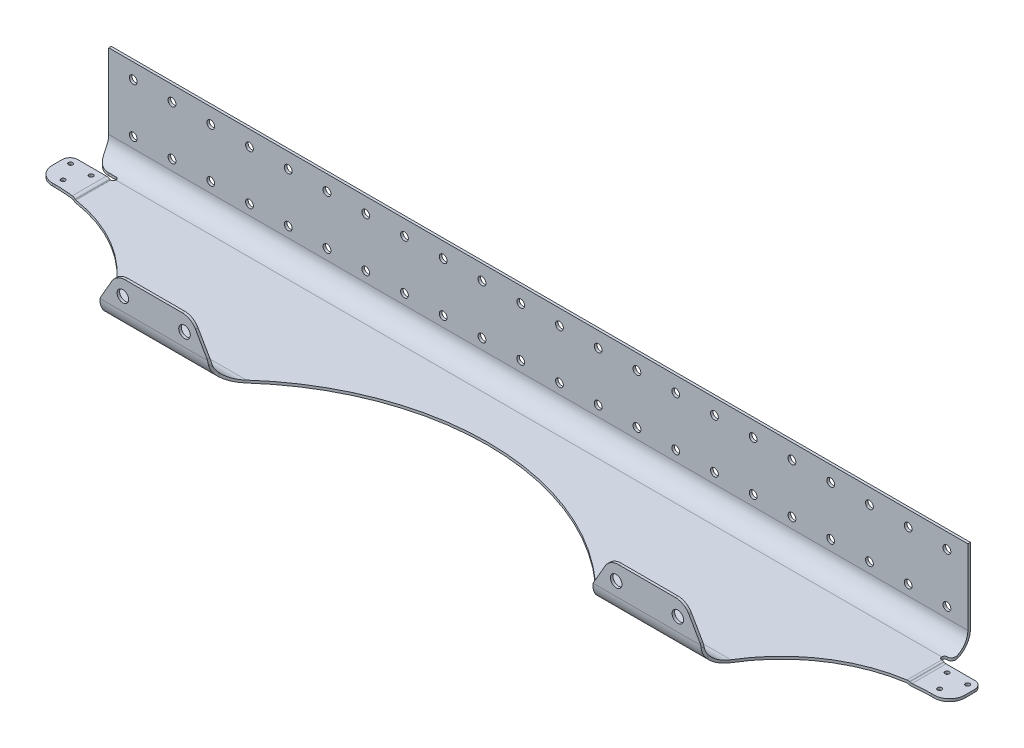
SolidWorks part; units mm, degrees
ref_plane "Front Plane" through (0, 0, 0) normal (1, 0, 0) x (0, 1, 0)
ref_plane "Top Plane" through (0, 0, 0) normal (0, 0, 1) x (0, 1, 0)
ref_plane "Right Plane" through (0, 0, 0) normal (0, 1, 0) x (-1, 0, 0)
sketch "sk 5dia hole pat" plane through (0, 0, 0) normal (0, 0, 1) x (0, 1, 0)
  line L4 (-30.48, -48.26) -> (30.48, -48.26) construction
  point P3 (0, -48.26)
  circle B0 centre (30.48, -579.12) radius 4.826
  circle B1 centre (1188.72, 579.12) radius 4.826
  circle B2 centre (78.74, -579.12) radius 4.826
  circle B3 centre (127, -579.12) radius 4.826
  circle B4 centre (175.26, -579.12) radius 4.826
  circle B5 centre (223.52, -579.12) radius 4.826
  circle B6 centre (271.78, -579.12) radius 4.826
  circle B7 centre (320.04, -579.12) radius 4.826
  circle B8 centre (368.3, -579.12) radius 4.826
  circle B9 centre (416.56, -579.12) radius 4.826
  circle B10 centre (464.82, -579.12) radius 4.826
  circle B11 centre (513.08, -579.12) radius 4.826
  circle B12 centre (561.34, -579.12) radius 4.826
  circle B13 centre (609.6, -579.12) radius 4.826
  circle B14 centre (657.86, -579.12) radius 4.826
  circle B15 centre (706.12, -579.12) radius 4.826
  circle B16 centre (754.38, -579.12) radius 4.826
  circle B17 centre (802.64, -579.12) radius 4.826
  circle B18 centre (850.9, -579.12) radius 4.826
  circle B19 centre (899.16, -579.12) radius 4.826
  circle B20 centre (947.42, -579.12) radius 4.826
  circle B21 centre (995.68, -579.12) radius 4.826
  circle B22 centre (1043.94, -579.12) radius 4.826
  circle B23 centre (1092.2, -579.12) radius 4.826
  circle B24 centre (1140.46, -579.12) radius 4.826
  circle B25 centre (1188.72, -579.12) radius 4.826
  circle B26 centre (30.48, -530.86) radius 4.826
  circle B27 centre (30.48, -482.6) radius 4.826
  circle B28 centre (30.48, -434.34) radius 4.826
  circle B29 centre (30.48, -386.08) radius 4.826
  circle B30 centre (30.48, -337.82) radius 4.826
  circle B31 centre (30.48, -289.56) radius 4.826
  circle B32 centre (30.48, -241.3) radius 4.826
  circle B33 centre (30.48, -193.04) radius 4.826
  circle B34 centre (30.48, -144.78) radius 4.826
  circle B35 centre (30.48, -96.52) radius 4.826
  circle B36 centre (30.48, -48.26) radius 4.826
  circle B37 centre (30.48, 0) radius 4.826
  circle B38 centre (30.48, 48.26) radius 4.826
  circle B39 centre (30.48, 96.52) radius 4.826
  circle B40 centre (30.48, 144.78) radius 4.826
  circle B41 centre (30.48, 193.04) radius 4.826
  circle B42 centre (30.48, 241.3) radius 4.826
  circle B43 centre (30.48, 289.56) radius 4.826
  circle B44 centre (30.48, 337.82) radius 4.826
  circle B45 centre (30.48, 386.08) radius 4.826
  circle B46 centre (30.48, 434.34) radius 4.826
  circle B47 centre (30.48, 482.6) radius 4.826
  circle B48 centre (30.48, 530.86) radius 4.826
  circle B49 centre (30.48, 579.12) radius 4.826
  circle B50 centre (1140.46, 579.12) radius 4.826
  circle B51 centre (1092.2, 579.12) radius 4.826
  circle B52 centre (1043.94, 579.12) radius 4.826
  circle B53 centre (995.68, 579.12) radius 4.826
  circle B54 centre (947.42, 579.12) radius 4.826
  circle B55 centre (899.16, 579.12) radius 4.826
  circle B56 centre (850.9, 579.12) radius 4.826
  circle B57 centre (802.64, 579.12) radius 4.826
  circle B58 centre (754.38, 579.12) radius 4.826
  circle B59 centre (706.12, 579.12) radius 4.826
  circle B60 centre (657.86, 579.12) radius 4.826
  circle B61 centre (609.6, 579.12) radius 4.826
  circle B62 centre (561.34, 579.12) radius 4.826
  circle B63 centre (513.08, 579.12) radius 4.826
  circle B64 centre (464.82, 579.12) radius 4.826
  circle B65 centre (416.56, 579.12) radius 4.826
  circle B66 centre (368.3, 579.12) radius 4.826
  circle B67 centre (320.04, 579.12) radius 4.826
  circle B68 centre (271.78, 579.12) radius 4.826
  circle B69 centre (223.52, 579.12) radius 4.826
  circle B70 centre (175.26, 579.12) radius 4.826
  circle B71 centre (127, 579.12) radius 4.826
  circle B72 centre (78.74, 579.12) radius 4.826
  circle B73 centre (1188.72, 530.86) radius 4.826
  circle B74 centre (1188.72, 482.6) radius 4.826
  circle B75 centre (1188.72, 434.34) radius 4.826
  circle B76 centre (1188.72, 386.08) radius 4.826
  circle B77 centre (1188.72, 337.82) radius 4.826
  circle B78 centre (1188.72, 289.56) radius 4.826
  circle B79 centre (1188.72, 241.3) radius 4.826
  circle B80 centre (1188.72, 193.04) radius 4.826
  circle B81 centre (1188.72, 144.78) radius 4.826
  circle B82 centre (1188.72, 96.52) radius 4.826
  circle B83 centre (1188.72, 48.26) radius 4.826
  circle B84 centre (1188.72, 0) radius 4.826
  circle B85 centre (1188.72, -48.26) radius 4.826
  circle B86 centre (1188.72, -96.52) radius 4.826
  circle B87 centre (1188.72, -144.78) radius 4.826
  circle B88 centre (1188.72, -193.04) radius 4.826
  circle B89 centre (1188.72, -241.3) radius 4.826
  circle B90 centre (1188.72, -289.56) radius 4.826
  circle B91 centre (1188.72, -337.82) radius 4.826
  circle B92 centre (1188.72, -386.08) radius 4.826
  circle B93 centre (1188.72, -434.34) radius 4.826
  circle B94 centre (1188.72, -482.6) radius 4.826
  circle B95 centre (1188.72, -530.86) radius 4.826
  line B96 (609.6, -579.12) -> (609.6, -504.12) construction
  line B97 (30.48, 0) -> (105.48, 0) construction
  circle B98 centre (-30.48, 579.12) radius 4.826
  circle B99 centre (-175.26, -579.12) radius 4.826
  circle B100 centre (-127, -579.12) radius 4.826
  circle B101 centre (-30.48, -579.12) radius 4.826
  circle B102 centre (-1188.72, 96.52) radius 4.826
  circle B103 centre (-127, 579.12) radius 4.826
  circle B104 centre (-464.82, 579.12) radius 4.826
  circle B105 centre (-513.08, 579.12) radius 4.826
  circle B106 centre (-706.12, 579.12) radius 4.826
  circle B107 centre (-754.38, 579.12) radius 4.826
  circle B108 centre (-899.16, 579.12) radius 4.826
  circle B109 centre (-30.48, 530.86) radius 4.826
  circle B110 centre (-30.48, 482.6) radius 4.826
  circle B111 centre (-30.48, 434.34) radius 4.826
  circle B112 centre (-30.48, 386.08) radius 4.826
  circle B113 centre (-30.48, 337.82) radius 4.826
  circle B114 centre (-30.48, 289.56) radius 4.826
  circle B115 centre (-30.48, 241.3) radius 4.826
  circle B116 centre (-30.48, 193.04) radius 4.826
  circle B117 centre (-30.48, 144.78) radius 4.826
  circle B118 centre (-30.48, 96.52) radius 4.826
  circle B119 centre (-30.48, 48.26) radius 4.826
  circle B120 centre (-30.48, 0) radius 4.826
  circle B121 centre (-30.48, -48.26) radius 4.826
  circle B122 centre (-30.48, -96.52) radius 4.826
  circle B123 centre (-30.48, -144.78) radius 4.826
  circle B124 centre (-30.48, -241.3) radius 4.826
  circle B125 centre (-30.48, -289.56) radius 4.826
  circle B126 centre (-30.48, -337.82) radius 4.826
  circle B127 centre (-30.48, -386.08) radius 4.826
  circle B128 centre (-30.48, -434.34) radius 4.826
  circle B129 centre (-30.48, -482.6) radius 4.826
  circle B130 centre (-30.48, -530.86) radius 4.826
  line B131 (-1188.72, 0) -> (-1113.72, 0) construction
  dimension "D1" = 60.96
sketch_block_instance "5dia hole pat-1"
sketch_block "5dia hole pat" parameters "D1"=9.652, "D2"=9.652, "D3"=75
sketch_block_instance "5dia hole pat-2"
sketch "sk 47.986in pnl" plane through (0, 0, 0) normal (0, 0, 1) x (0, 1, 0)
  line B0 (0.1778, 0) -> (1219.0222, 0) construction
  line B1 (0.1778, 609.4222) -> (1219.0222, 609.4222)
  line B2 (0.1778, 609.4222) -> (0.1778, -609.4222)
  line B3 (0.1778, -609.4222) -> (1219.0222, -609.4222)
  line B4 (1219.0222, 609.4222) -> (1219.0222, -609.4222)
  line B5 (609.6, 609.4222) -> (609.6, -609.4222) construction
  dimension "D1" = 30.3022
sketch_block_instance "47.986in pnl-1"
sketch_block "47.986in pnl" parameters "D1"=1218.8444, "D2"=1218.8444
sketch "sk main body" plane through (0, 0, 0) normal (1, 0, 0) x (0, 1, 0)
  line L0 (49.53, 0) -> (-43.18, 0)
  line L1 (-68.58, 25.4) -> (-68.58, 158.75)
  line L2 (-43.18, 184.15) -> (-7.62, 184.15)
  line L3 (-26.67, 213.8401) -> (-26.67, 147.2198) construction
  line L4 (49.53, 3.175) -> (-43.18, 3.175)
  line L5 (-65.405, 25.4) -> (-65.405, 158.75)
  line L6 (-43.18, 180.975) -> (-7.62, 180.975)
  line L7 (-7.62, 184.15) -> (-7.62, 180.975)
  line L8 (49.53, 3.175) -> (49.53, 0)
  line L9 (670.3644, 0) -> (-670.3644, 0) construction
  arc A0 (-43.18, 0) -> (-68.58, 25.4) centre (-43.18, 25.4) cw
  arc A1 (-68.58, 158.75) -> (-43.18, 184.15) centre (-43.18, 158.75) cw
  arc A2 (-43.18, 3.175) -> (-65.405, 25.4) centre (-43.18, 25.4) cw
  arc A3 (-65.405, 158.75) -> (-43.18, 180.975) centre (-43.18, 158.75) cw
  dimension "D2" = 25.4
  dimension "D1" = 19.05
  dimension "D3" = 12.7
  dimension "D4" = 16.51
  dimension "D5" = 19.05
  dimension "D7" = 177.8
  dimension "D6" = 3.175
extrude "main body" add sketch "sk main body" along normal mid plane 1082.7022
sketch "sk upper holes" plane through (0, 0, 184.15) normal (0, 0, 1) x (1, 0, 0)
  line L0 (-609.4222, 0.1778) -> (-609.4222, 1219.0222) construction
  line L1 (609.4222, 0.1778) -> (609.4222, 1219.0222) construction
  line L2 (541.3511, -7.62) -> (-541.3511, -7.62) construction
  circle A2 centre (-342.9, -26.67) radius 16.51 construction
  circle A3 centre (-266.7, -26.67) radius 16.51 construction
  circle A4 centre (266.7, -26.67) radius 16.51 construction
  circle A5 centre (342.9, -26.67) radius 16.51 construction
  line B0 (-342.9, -26.67) -> (-266.7, -26.67) construction
  circle B1 centre (-342.9, -26.67) radius 7.1438
  circle B2 centre (-266.7, -26.67) radius 7.1438
  line B3 (266.7, -26.67) -> (342.9, -26.67) construction
  circle B4 centre (266.7, -26.67) radius 7.1438
  circle B5 centre (342.9, -26.67) radius 7.1438
  dimension "D1" = 304.8
  dimension "D2" = 304.8
  dimension "D6" = 33.02
  dimension "D7" = 33.02
  dimension "D8" = 33.02
  dimension "D9" = 33.02
  dimension "D3" = 304.6222
  dimension "D4" = 304.6222
  dimension "D5" = 19.05
sketch_block_instance "Upper bolt holes-1"
sketch_block "Upper bolt holes" parameters "D1"=14.2875, "D2"=14.2875, "D3"=76.2
sketch_block_instance "Upper bolt holes-2"
sketch "Sketch6" plane through (0, 0, 184.15) normal (0, 0, 1) x (1, 0, 0)
  line L0 (-371.4962, -43.18) -> (-304.8, 72.3411)
  line L1 (541.3511, -43.18) -> (-541.3511, -43.18) construction
  line L2 (-304.8, 72.3411) -> (-238.1038, -43.18)
  line L3 (-371.4962, -43.18) -> (-638.8127, -43.18)
  line L4 (-638.8127, -43.18) -> (-638.8127, 115.8831)
  line L6 (238.1038, -43.18) -> (304.8, 72.3411)
  line L7 (304.8, 72.3411) -> (371.4962, -43.18)
  line L8 (371.4962, -43.18) -> (645.1619, -43.18)
  line L9 (645.1619, -43.18) -> (645.1619, 115.8831)
  line L10 (-238.1038, -43.18) -> (238.1038, -43.18)
  line L11 (-638.8127, 115.8831) -> (645.1619, 115.8831)
  circle A0 centre (-342.9, -26.67) radius 16.51 construction
  circle A1 centre (-266.7, -26.67) radius 16.51 construction
  circle A2 centre (342.9, -26.67) radius 16.51 construction
  circle A3 centre (266.7, -26.67) radius 16.51 construction
  dimension "D1" = 60
  dimension "D2" = 60
  dimension "D3" = 60
  dimension "D4" = 60
extrude "Upper tabs" cut sketch "Sketch6" against normal blind 10
sketch "Sketch7" plane through (0, 0, 0) normal (0, 1, 0) x (-1, 0, 0)
  line L0 (-238.1038, 180.975) -> (-238.1038, 196.2087)
  line L4 (-238.1038, 196.2087) -> (238.1038, 196.2087)
  line L5 (238.1038, 196.2087) -> (238.1038, 180.975)
  line L6 (-541.3511, 25.4) -> (541.3511, 25.4) construction
  arc A2 (-238.1038, 180.975) -> (238.1038, 180.975) centre (0, 399.136) ccw
  point P2 (0, 76.2)
  dimension "D1" = 50.8
extrude "Side Mid curve" cut sketch "Sketch7" against normal through all
sketch "5dia hole for part" plane through (0, 0, 0) normal (0, 0, 1) x (0, 1, 0)
  line L1 (49.53, -541.3511) -> (49.53, 541.3511) construction
  line L2 (-43.18, -541.3511) -> (-43.18, 541.3511) construction
  line L3 (49.53, 541.3511) -> (-43.18, 541.3511) construction
  circle A52 centre (-30.48, 511.0489) radius 4.826
  circle A53 centre (30.48, 511.0489) radius 4.826
  circle A54 centre (30.48, 463.1699) radius 4.826
  circle A55 centre (-30.48, 463.1699) radius 4.826
  circle A56 centre (30.48, 415.2909) radius 4.826
  circle A57 centre (-30.48, 415.2909) radius 4.826
  circle A58 centre (30.48, 367.4119) radius 4.826
  circle A59 centre (-30.48, 367.4119) radius 4.826
  circle A60 centre (30.48, 319.5329) radius 4.826
  circle A61 centre (-30.48, 319.5329) radius 4.826
  circle A62 centre (30.48, 271.6539) radius 4.826
  circle A63 centre (-30.48, 271.6539) radius 4.826
  circle A64 centre (30.48, 223.7749) radius 4.826
  circle A65 centre (-30.48, 223.7749) radius 4.826
  circle A66 centre (30.48, 175.8959) radius 4.826
  circle A67 centre (-30.48, 175.8959) radius 4.826
  circle A68 centre (30.48, 128.0169) radius 4.826
  circle A69 centre (-30.48, 128.0169) radius 4.826
  circle A70 centre (30.48, 80.1379) radius 4.826
  circle A71 centre (-30.48, 80.1379) radius 4.826
  circle A72 centre (30.48, 32.2589) radius 4.826
  circle A73 centre (-30.48, 32.2589) radius 4.826
  circle A74 centre (30.48, -15.6201) radius 4.826
  circle A75 centre (-30.48, -15.6201) radius 4.826
  circle A76 centre (30.48, -63.4991) radius 4.826
  circle A77 centre (-30.48, -63.4991) radius 4.826
  circle A78 centre (30.48, -111.3781) radius 4.826
  circle A79 centre (-30.48, -111.3781) radius 4.826
  circle A80 centre (30.48, -159.2571) radius 4.826
  circle A81 centre (-30.48, -159.2571) radius 4.826
  circle A82 centre (30.48, -207.1361) radius 4.826
  circle A83 centre (-30.48, -207.1361) radius 4.826
  circle A84 centre (30.48, -255.0151) radius 4.826
  circle A85 centre (-30.48, -255.0151) radius 4.826
  circle A86 centre (30.48, -302.8941) radius 4.826
  circle A87 centre (-30.48, -302.8941) radius 4.826
  circle A88 centre (30.48, -350.7731) radius 4.826
  circle A89 centre (-30.48, -350.7731) radius 4.826
  circle A90 centre (30.48, -398.6521) radius 4.826
  circle A91 centre (-30.48, -398.6521) radius 4.826
  circle A92 centre (30.48, -446.5311) radius 4.826
  circle A93 centre (-30.48, -446.5311) radius 4.826
  circle A94 centre (30.48, -494.4101) radius 4.826
  circle A95 centre (-30.48, -494.4101) radius 4.826
  dimension "D4" = 9.652
  dimension "D5" = 9.652
  dimension "D1" = 30.3022
  dimension "D2" = 19.05
  dimension "D3" = 12.7
  dimension "D6" = 22
extrude "Holes Bot" cut sketch "5dia hole for part" along normal blind 10
extrude "Holes Top" cut sketch "sk upper holes" against normal blind 10
ref_plane "Tab Lower pln" through (0, 0, 25.4) normal (0, 0, 1) x (0, 1, 0)
sketch "sk Rivet holes" plane through (0, 0, 0) normal (0, 1, 0) x (-1, 0, 0)
  line L1 (541.3511, 0) -> (541.3511, 3.175) construction
  line L3 (64.9605, 25.4) -> (-64.9605, 25.4) construction
  line L5 (-541.3511, 25.4) -> (-541.3511, 158.75) construction
  circle A0 centre (554.2289, 37.4) radius 10 construction
  circle A1 centre (541.5289, 59.397) radius 10 construction
  circle A2 centre (528.8289, 37.4) radius 10 construction
  circle A3 centre (-541.5289, 59.397) radius 10 construction
  circle A4 centre (-528.8289, 37.4) radius 10 construction
  circle A6 centre (-554.2289, 37.4) radius 10 construction
  point P5 (554.2289, 34.8092)
  point P9 (554.2289, 27.4)
  point P20 (564.2289, 37.4)
  point P21 (-564.2289, 37.4)
  point P22 (518.8289, 37.4)
  point P23 (-518.8289, 37.4)
  point P24 (541.5289, 69.397)
  point P25 (-541.5289, 69.397)
  line B0 (528.8289, 37.4) -> (541.5289, 59.397) construction
  line B1 (541.5289, 59.397) -> (554.2289, 37.4) construction
  line B2 (554.2289, 37.4) -> (528.8289, 37.4) construction
  circle B3 centre (528.8289, 37.4) radius 2.5908
  circle B4 centre (554.2289, 37.4) radius 2.5908
  circle B5 centre (541.5289, 59.397) radius 2.5908
  line B6 (535.1789, 48.3985) -> (541.5289, 44.7323) construction
  line B7 (541.5289, 37.4) -> (541.5289, 44.7323) construction
  line B8 (-554.2289, 37.4) -> (-541.5289, 59.397) construction
  line B9 (-541.5289, 59.397) -> (-528.8289, 37.4) construction
  line B10 (-528.8289, 37.4) -> (-554.2289, 37.4) construction
  circle B11 centre (-554.2289, 37.4) radius 2.5908
  circle B12 centre (-528.8289, 37.4) radius 2.5908
  circle B13 centre (-541.5289, 59.397) radius 2.5908
  line B14 (-547.8789, 48.3985) -> (-541.5289, 44.7323) construction
  line B15 (-541.5289, 37.4) -> (-541.5289, 44.7323) construction
  dimension "D4" = 20
  dimension "D6" = 20
  dimension "D7" = 20
  dimension "D8" = 20
  dimension "D9" = 20
  dimension "D10" = 20
  dimension "D1" = 0.1778
  dimension "D2" = 12
  dimension "D3" = 0.1778
  dimension "D5" = 7.4092
sketch_block_instance "Blind Rivet holes-1"
sketch_block "Blind Rivet holes" parameters "D1"=5.1816, "D2"=5.1816, "D3"=5.1816, "D4"=60, "D5"=60, "D6"=25.4, "D7"=25.4, "D8"=25.4
sketch_block_instance "Blind Rivet holes-2"
sketch "sk Vtab" plane through (0, 0, 25.4) normal (0, 0, 1) x (0, 1, 0)
  line L8 (-68.58, -541.3511) -> (-68.58, 541.3511) construction
  line B0 (-68.58, 511.3998) -> (-68.58, 513.3998)
  line B1 (-67.9101, 515.8998) -> (-67.6624, 516.3289)
  line B2 (-66.9925, 518.8289) -> (-66.9925, 563.8289)
  line B3 (-65.405, 511.3998) -> (-65.405, 513.3998)
  line B4 (-65.1605, 514.3123) -> (-64.9127, 514.7414)
  line B5 (-63.8175, 518.8289) -> (-63.8175, 563.8289)
  line B6 (-68.58, 511.3998) -> (-65.405, 511.3998)
  line B7 (-63.8175, 563.8289) -> (-66.9925, 563.8289)
  arc B8 (-67.6624, 516.3289) -> (-66.9925, 518.8289) centre (-71.9925, 518.8289) ccw
  arc B9 (-68.58, 513.3998) -> (-67.9101, 515.8998) centre (-63.58, 513.3998) cw
  arc B10 (-65.405, 513.3998) -> (-65.1605, 514.3123) centre (-63.58, 513.3998) cw
  arc B11 (-64.9127, 514.7414) -> (-63.8175, 518.8289) centre (-71.9925, 518.8289) ccw
  line B12 (-65.405, -511.3998) -> (-65.405, -513.3998)
  line B13 (-66.0749, -515.8998) -> (-66.3226, -516.3289)
  line B14 (-66.9925, -518.8289) -> (-66.9925, -563.8289)
  line B15 (-68.58, -511.3998) -> (-68.58, -513.3998)
  line B16 (-68.8245, -514.3123) -> (-69.0723, -514.7414)
  line B17 (-70.1675, -518.8289) -> (-70.1675, -563.8289)
  line B18 (-65.405, -511.3998) -> (-68.58, -511.3998)
  line B19 (-70.1675, -563.8289) -> (-66.9925, -563.8289)
  arc B20 (-66.3226, -516.3289) -> (-66.9925, -518.8289) centre (-61.9925, -518.8289) ccw
  arc B21 (-65.405, -513.3998) -> (-66.0749, -515.8998) centre (-70.405, -513.3998) cw
  arc B22 (-68.58, -513.3998) -> (-68.8245, -514.3123) centre (-70.405, -513.3998) cw
  arc B23 (-69.0723, -514.7414) -> (-70.1675, -518.8289) centre (-61.9925, -518.8289) ccw
sketch_block_instance "V tab-1"
sketch_block "V tab" parameters "D3"=5, "D1"=30, "D2"=1.5875, "D4"=2, "D5"=24.625
sketch_block_instance "V tab-2"
sketch "sk Vtab precut" plane through (0, 0, 25.4) normal (0, 0, 1) x (0, 1, 0)
  line L1 (-68.58, 513.3998) -> (-25.5629, 513.3998)
  line L2 (-68.58, 513.3998) -> (-68.58, 628.7058)
  line L3 (-68.58, 628.7058) -> (-25.5629, 628.7058)
  line L4 (-25.5629, 513.3998) -> (-25.5629, 628.7058)
  line L5 (-68.58, -513.3998) -> (-35.8904, -513.3998)
  line L6 (-68.58, -513.3998) -> (-68.58, -622.8382)
  line L7 (-68.58, -622.8382) -> (-35.8904, -622.8382)
  line L8 (-35.8904, -513.3998) -> (-35.8904, -622.8382)
sketch "Sketch9" plane through (0, 0, 0) normal (0, 1, 0) x (-1, 0, 0)
  line L6 (371.4962, 180.975) -> (371.4962, 193.3104)
  line L7 (371.4962, 193.3104) -> (736.1624, 193.3104)
  line L8 (736.1624, 193.3104) -> (736.1624, 69.397)
  line L9 (736.1624, 69.397) -> (541.5289, 69.397)
  line L10 (-371.4962, 180.975) -> (-371.4962, 190.6931)
  line L11 (-371.4962, 190.6931) -> (-686.7988, 190.6931)
  line L12 (-686.7988, 190.6931) -> (-686.7988, 69.397)
  line L13 (-686.7988, 69.397) -> (-541.5289, 69.397)
  arc A2 (371.4962, 180.975) -> (541.5289, 69.397) centre (541.5289, 254.7418) ccw
  arc A3 (-371.4962, 180.975) -> (-541.5289, 69.397) centre (-541.5289, 254.7418) cw
  circle A4 centre (-541.5289, 59.397) radius 10 construction
extrude "Cut-Extrude5" cut sketch "sk Vtab precut" along normal through all
extrude "Side Tabs" add sketch "sk Vtab" along normal blind 50
sketch "Sketch11" plane through (0, 0, 0) normal (0, 1, 0) x (-1, 0, 0)
  line L0 (513.3998, 25.4) -> (667.6325, 25.4) construction
  line L1 (513.3998, 28.575) -> (667.6325, 28.575)
  line L2 (513.3998, 22.225) -> (667.6325, 22.225)
  line L4 (-513.3998, 25.4) -> (513.3998, 25.4) construction
  line L5 (513.3998, 75.4) -> (513.3998, 25.4) construction
  line L6 (-513.3998, 25.4) -> (-658.6998, 25.4) construction
  line L7 (-513.3998, 22.225) -> (-658.6998, 22.225)
  line L8 (-513.3998, 28.575) -> (-658.6998, 28.575)
  line L9 (-513.3998, 25.4) -> (-513.3998, 75.4) construction
  arc A0 (513.3998, 28.575) -> (513.3998, 22.225) centre (513.3998, 25.4) ccw
  arc A1 (667.6325, 22.225) -> (667.6325, 28.575) centre (667.6325, 25.4) ccw
  arc A2 (-513.3998, 22.225) -> (-513.3998, 28.575) centre (-513.3998, 25.4) ccw
  arc A3 (-658.6998, 28.575) -> (-658.6998, 22.225) centre (-658.6998, 25.4) ccw
  point P2 (590.5161, 25.4)
  point P7 (-586.0498, 25.4)
  dimension "D1" = 3.175
  dimension "D2" = 3.175
extrude "tab undercut" cut sketch "Sketch11" against normal through all
extrude "Outer curve cut" cut sketch "Sketch9" against normal through all
fillet "Fillet1" radius 19.05 12 edges at (-541.3511, -66.7789, 22.225) (541.3511, -66.7789, 22.225) (563.8289, -68.58, 69.397) (-563.8289, -65.405, 69.397) (-371.4962, -49.3284, 180.975) (-238.1038, -49.3284, 180.975) (371.4962, -49.3284, 180.975) (238.1038, -49.3284, 180.975) (350.9656, -7.62, 182.5625) (258.6344, -7.62, 182.5625) (-258.6344, -7.62, 182.5625) (-350.9656, -7.62, 182.5625)
fillet "Fillet3" radius 9.525 6 edges at (563.8289, -68.58, 28.575) (-563.8289, -65.405, 28.575) (237.1094, -44.9024, 182.4383) (371.6602, -43.4641, 182.547) (-237.1094, -44.9024, 182.4383) (-371.6602, -43.4641, 182.547)
extrude "Tab Holes" cut sketch "sk Rivet holes" against normal through all
sketch "Sketch12" plane through (0, 0, 0) normal (0, 1, 0) x (-1, 0, 0)
  line L0 (-541.3511, 0) -> (-541.3511, 3.175) construction
  line L1 (-584.2744, 24.2656) -> (-520.2936, 24.2656)
  line L2 (-584.2744, 24.2656) -> (-584.2744, -24.1726)
  line L3 (-584.2744, -24.1726) -> (-520.2936, -24.1726)
  line L4 (-520.2936, 24.2656) -> (-520.2936, -24.1726)
  dimension "D1" = 21.0575
extrude "Cut-Extrude6" cut sketch "Sketch12" against normal through all both and the other way through all
fillet "Fillet4" radius 6.35 1 edges at (520.2936, -66.7789, 22.225)
equation "\"3i\"=138.375"
equation "\".75i\"=12.7"
